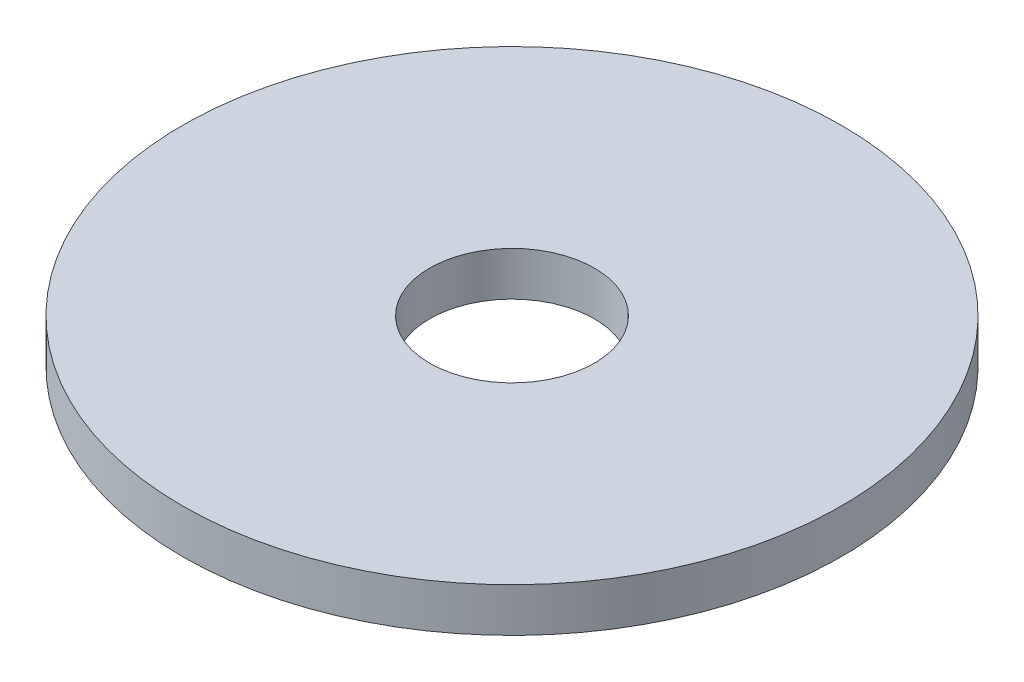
SolidWorks part; units mm, degrees
ref_plane "Face" through (0, 0, 0) normal (0, 0, 1) x (1, 0, 0)
ref_plane "Dessus" through (0, 0, 0) normal (0, 1, 0) x (1, 0, 0)
ref_plane "Droite" through (0, 0, 0) normal (1, 0, 0) x (0, 0, -1)
sketch "Esquisse1" plane through (0, 0, 0) normal (0, 1, 0) x (1, 0, 0)
  circle A0 centre (0, 0) radius 6
  circle A1 centre (0, 0) radius 1.5
  dimension "D1" = 12
  dimension "D2" = 3
extrude "Extrusion1" add sketch "Esquisse1" along normal blind 0.8
sketch "Esquisse2" plane through (0, 0, 0) normal (0, 0, 1) x (1, 0, 0)
  line L0 (0, 4.6708) -> (0, 0.8) construction
  line L1 (0, 0) -> (6, 0)
  line L2 (0, 0) -> (0, 0.8)
  line L3 (0, 0.8) -> (6, 0.8)
  line L4 (6, 0) -> (6, 0.8)
  line L6 (-6, 0) -> (6, 0) construction
  line L7 (6, 0.8) -> (-6, 0.8) construction
revolve "Coupe" cut sketch "Esquisse2" angle 180 about L0
